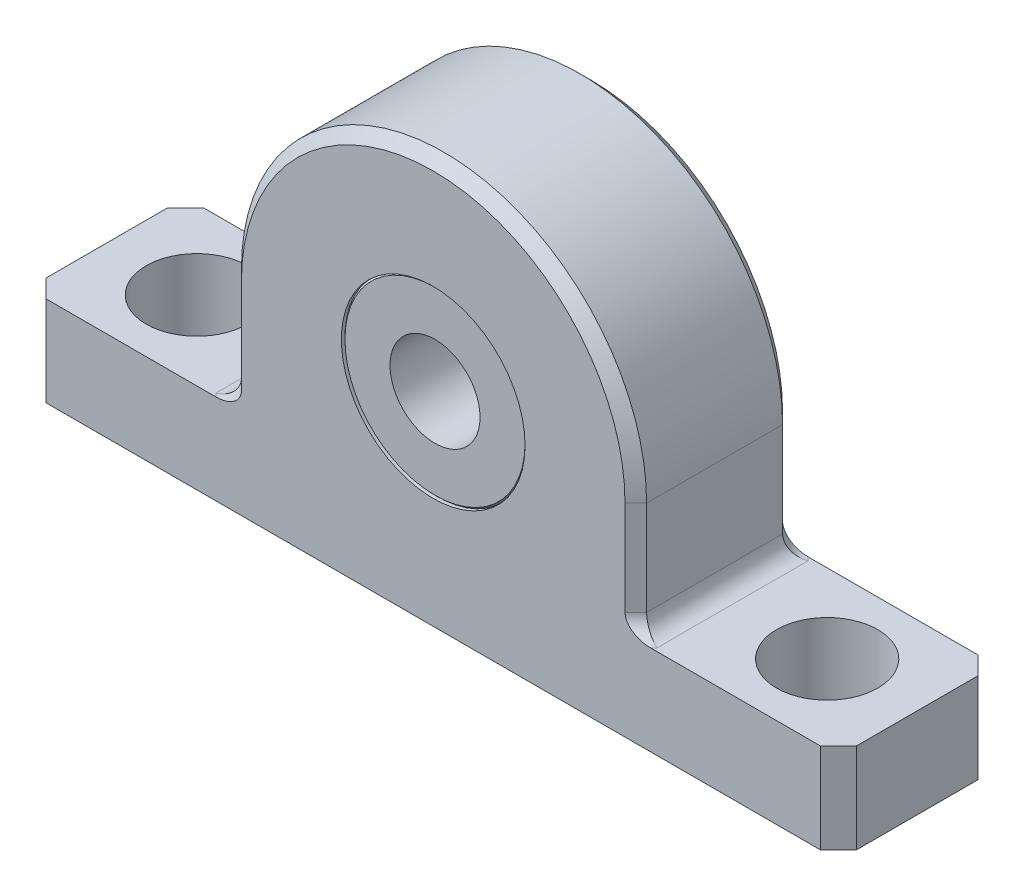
SolidWorks part; units mm, degrees
ref_plane "Front" through (0, 0, 0) normal (0, 0, 1) x (1, 0, 0)
ref_plane "Top" through (0, 0, 0) normal (0, 1, 0) x (1, 0, 0)
ref_plane "Right" through (0, 0, 0) normal (1, 0, 0) x (0, 0, -1)
sketch "Sketch1" plane through (0, 0, 0) normal (0, 0, 1) x (1, 0, 0)
  line L0 (-14.2875, 0) -> (-14.2875, -7.9375)
  line L1 (-14.2875, -7.9375) -> (-28.575, -7.9375)
  line L2 (-28.575, -7.9375) -> (-28.575, -14.2875)
  line L3 (-28.575, -14.2875) -> (28.575, -14.2875)
  line L4 (28.575, -14.2875) -> (28.575, -7.9375)
  line L5 (28.575, -7.9375) -> (14.2875, -7.9375)
  line L6 (14.2875, -7.9375) -> (14.2875, 0)
  line L7 (0, 0) -> (0, -14.2875) construction
  arc A0 (14.2875, 0) -> (-14.2875, 0) centre (0, 0) ccw
  dimension "length" = 57.15
  dimension "vert centerline" = 14.2875
  dimension "foot height" = 6.35
  dimension "height" = 28.575
extrude "Extrude1" add sketch "Sketch1" along normal mid plane 11.1125
chamfer "Chamfer1" distance 0.762 angle 45 6 edges at (-14.2875, -3.9688, -5.5562) (0, 14.2875, -5.5562) (14.2875, -3.9687, -5.5562) (-14.2875, -3.9688, 5.5562) (14.2875, -3.9687, 5.5562) (0, 14.2875, 5.5562)
fillet "Fillet1" radius 1.27 6 edges at (-14.2875, -7.9375, 0) (14.2875, -7.9375, 0) (13.9065, -7.9375, -5.1752) (13.9065, -7.9375, 5.1752) (-13.9065, -7.9375, -5.1752) (-13.9065, -7.9375, 5.1752)
chamfer "Chamfer2" distance 1.27 angle 45 4 edges at (-28.575, -11.1125, -5.5562) (-28.575, -11.1125, 5.5562) (28.575, -11.1125, -5.5562) (28.575, -11.1125, 5.5562)
sketch "Sketch3" plane through (0, 0, 0) normal (0, 0, 1) x (1, 0, 0)
  circle A0 centre (0, 0) radius 6.477
  dimension "thru dia" = 12.954
extrude "Cut-Extrude1" cut sketch "Sketch3" against normal through all and the other way through all
sketch "Sketch4" plane through (0, 0, 0) normal (1, 0, 0) x (0, 0, -1)
  line L0 (-8.8978, 0) -> (9.9548, 0) construction
  line L1 (31.4325, 0) -> (-31.4325, 0) construction
  line L2 (-5.4292, 0) -> (-5.4292, 6.35)
  line L3 (5.5563, 6.477) -> (-5.5563, 6.477) construction
  line L4 (-5.3022, 6.477) -> (-4.1593, 6.477)
  line L5 (-5.4292, 6.35) -> (-5.3022, 6.477)
  line L6 (-4.1593, 6.477) -> (-4.1592, 6.35)
  line L7 (-4.1592, 6.35) -> (5.5562, 6.35)
  line L8 (5.5562, 0) -> (5.5562, 13.5255) construction
  line L9 (5.5562, 6.35) -> (5.5562, 0)
  line L10 (5.5562, 0) -> (-5.4292, 0)
  line L11 (-5.5562, 13.5255) -> (-5.5562, 0) construction
  dimension "D1" = 0.127
  dimension "D2" = 12.7
  dimension "D3" = 1.27
  dimension "D4" = 135
  dimension "D5" = 0.127
revolve "Revolve1" add sketch "Sketch4" angle 360 about L0
sketch "Sketch5" plane through (0, 0, 0) normal (0, 0, 1) x (1, 0, 0)
  circle A0 centre (0, 0) radius 3.175
  dimension "shaft" = 6.35
extrude "Cut-Extrude2" cut sketch "Sketch5" against normal through all and the other way through all
sketch "Sketch6" plane through (0, 0, 0) normal (0, 1, 0) x (1, 0, 0)
  line L0 (-30.0221, 0) -> (29.6861, 0) construction
  line L1 (0, 7.1755) -> (0, -6.5996) construction
  circle A0 centre (-22.225, 0) radius 3.5719
  circle A1 centre (22.225, 0) radius 3.5719
  dimension "hole dia" = 7.1437
  dimension "hole centers" = 44.45
extrude "Cut-Extrude3" cut sketch "Sketch6" against normal through all
equation "\"D2@Sketch4\"=\"thru dia@Sketch3\"-.010"
